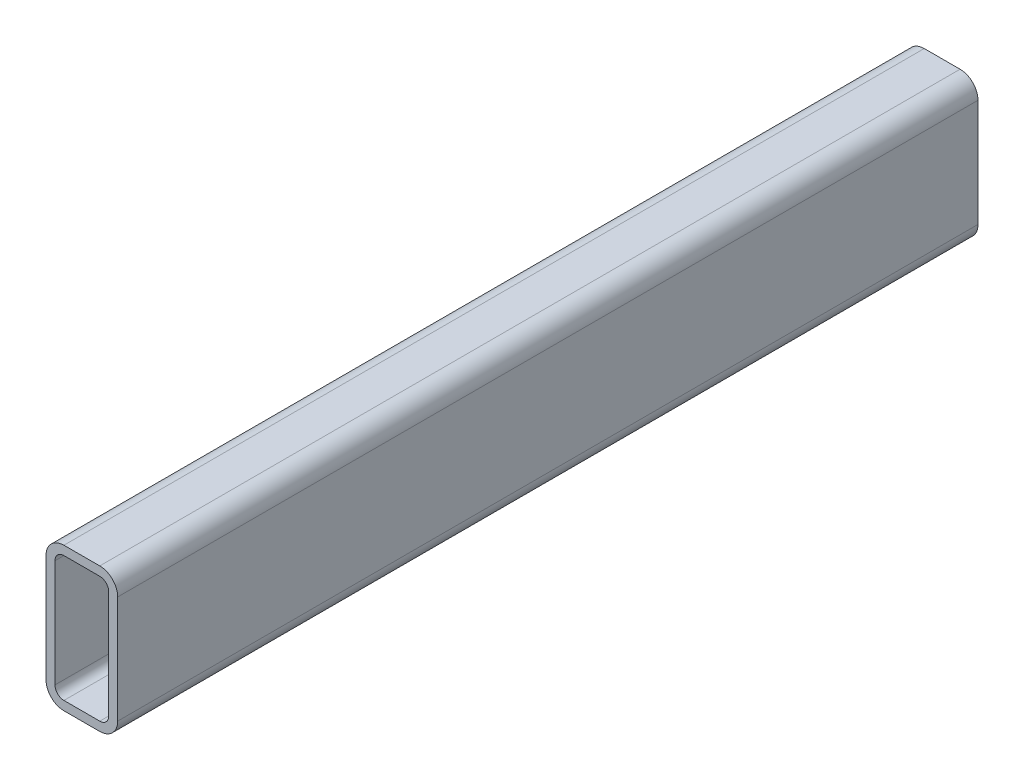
SolidWorks part; units mm, degrees
ref_plane "Front Plane" through (0, 0, 0) normal (0, 0, 1) x (1, 0, 0)
ref_plane "Top Plane" through (0, 0, 0) normal (0, 1, 0) x (1, 0, 0)
ref_plane "Right Plane" through (0, 0, 0) normal (1, 0, 0) x (0, 0, -1)
sketch "Sketch1" plane through (0, 0, 0) normal (0, 0, 1) x (1, 0, 0)
  line B0 (6.35, 50.8) -> (19.05, 50.8)
  arc B1 (25.4, 44.45) -> (19.05, 50.8) centre (19.05, 44.45) ccw
  line B2 (25.4, 44.45) -> (25.4, 6.35)
  arc B3 (19.05, 0) -> (25.4, 6.35) centre (19.05, 6.35) ccw
  line B4 (19.05, 0) -> (6.35, 0)
  arc B5 (0, 6.35) -> (6.35, 0) centre (6.35, 6.35) ccw
  line B6 (0, 6.35) -> (0, 44.45)
  arc B7 (6.35, 50.8) -> (0, 44.45) centre (6.35, 44.45) ccw
  line B8 (6.35, 47.625) -> (19.05, 47.625)
  arc B9 (22.225, 44.45) -> (19.05, 47.625) centre (19.05, 44.45) ccw
  line B10 (22.225, 44.45) -> (22.225, 6.35)
  arc B11 (19.05, 3.175) -> (22.225, 6.35) centre (19.05, 6.35) ccw
  line B12 (19.05, 3.175) -> (6.35, 3.175)
  arc B13 (3.175, 6.35) -> (6.35, 3.175) centre (6.35, 6.35) ccw
  line B14 (3.175, 6.35) -> (3.175, 44.45)
  arc B15 (6.35, 47.625) -> (3.175, 44.45) centre (6.35, 44.45) ccw
sketch_block_instance "HSS2x1x0.125-1"
sketch_block "HSS2x1x0.125"
extrude "Boss-Extrude1" add sketch "Sketch1" along normal blind 304.8
